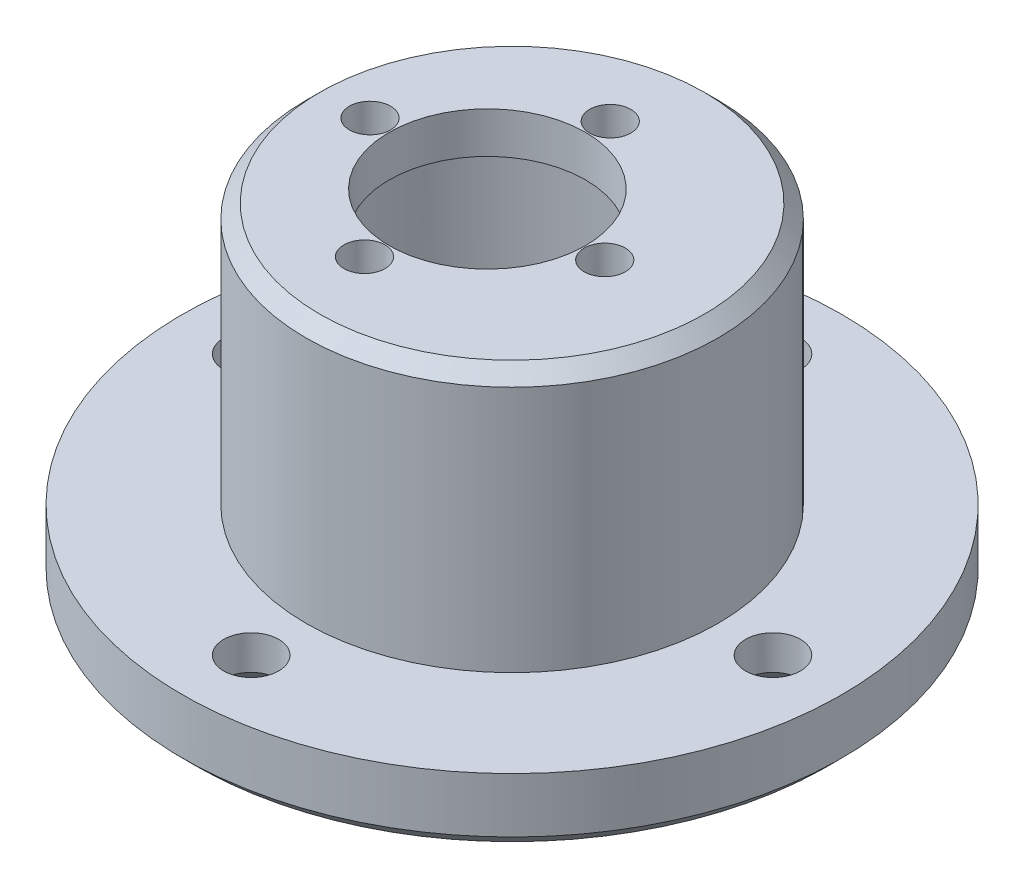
SolidWorks part; units mm, degrees
ref_plane "Plan de face" through (0, 0, 0) normal (0, 0, 1) x (1, 0, 0)
ref_plane "Plan de dessus" through (0, 0, 0) normal (0, 1, 0) x (1, 0, 0)
ref_plane "Plan de droite" through (0, 0, 0) normal (1, 0, 0) x (0, 0, -1)
sketch "Esquisse1" plane through (0, 0, 0) normal (0, 1, 0) x (1, 0, 0)
  circle A0 centre (0, 0) radius 15
  dimension "D1" = 30
extrude "Boss.-Extru.1" add sketch "Esquisse1" along normal blind 19
sketch "Esquisse3" plane through (0, 0, 0) normal (0, -1, 0) x (1, 0, 0)
  circle A0 centre (0, 0) radius 24
  dimension "D1" = 48
extrude "Boss.-Extru.2" add sketch "Esquisse3" along normal blind 5
chamfer "Chanfrein4" distance 1 angle 45 1 edges at (0, 19, 15)
chamfer "Chanfrein5" distance 1 angle 45 1 edges at (0, -5, -24)
sketch "Esquisse8" plane through (0, 19, 0) normal (0, 1, 0) x (1, 0, 0)
  circle A0 centre (0, 0) radius 11.25
extrude "Boss.-Extru.3" add sketch "Esquisse8" against normal blind 3
sketch "Esquisse9" plane through (0, 0, 0) normal (0, 1, 0) x (1, 0, 0)
  circle A0 centre (0, 19) radius 2
  dimension "D1" = 4
  dimension "D2" = 19
extrude "Enlèv. mat.-Extru.7" cut sketch "Esquisse9" against normal blind 10
chamfer "Chanfrein7" distance 2.5 angle 45 1 edges at (0, -5, -21)
pattern_circular "Répétition circulaire2" count 4 over 360 about axis through (0, 0, 0) along (0, 1, 0) of "Enlèv. mat.-Extru.7", "Chanfrein7"
sketch "Esquisse10" plane through (0, -5, 0) normal (0, -1, 0) x (1, 0, 0)
  circle A0 centre (-1.8, 0) radius 12.75
  dimension "D1" = 25.5
  dimension "D2" = 1.8
extrude "Enlèv. mat.-Extru.8" cut sketch "Esquisse10" against normal blind 21
sketch "Esquisse11" plane through (0, 16, 0) normal (0, -1, 0) x (1, 0, 0)
  circle A0 centre (-1.8, 0) radius 7.15
  dimension "D1" = 14.3
extrude "Enlèv. mat.-Extru.9" cut sketch "Esquisse11" against normal through all
sketch "Esquisse12" plane through (0, 19, 0) normal (0, 1, 0) x (1, 0, 0)
  circle A0 centre (-1.9999, -8.7477) radius 1.5
  circle A1 centre (-1.8, 0) radius 7.15 construction
  dimension "D1" = 8.75
  dimension "D2" = 3
extrude "Enlèv. mat.-Extru.11" cut sketch "Esquisse12" against normal through all
pattern_circular "Répétition circulaire3" count 4 over 360 about axis through (-1.8, 0, 0) along (0, 1, 0) of "Enlèv. mat.-Extru.11"
